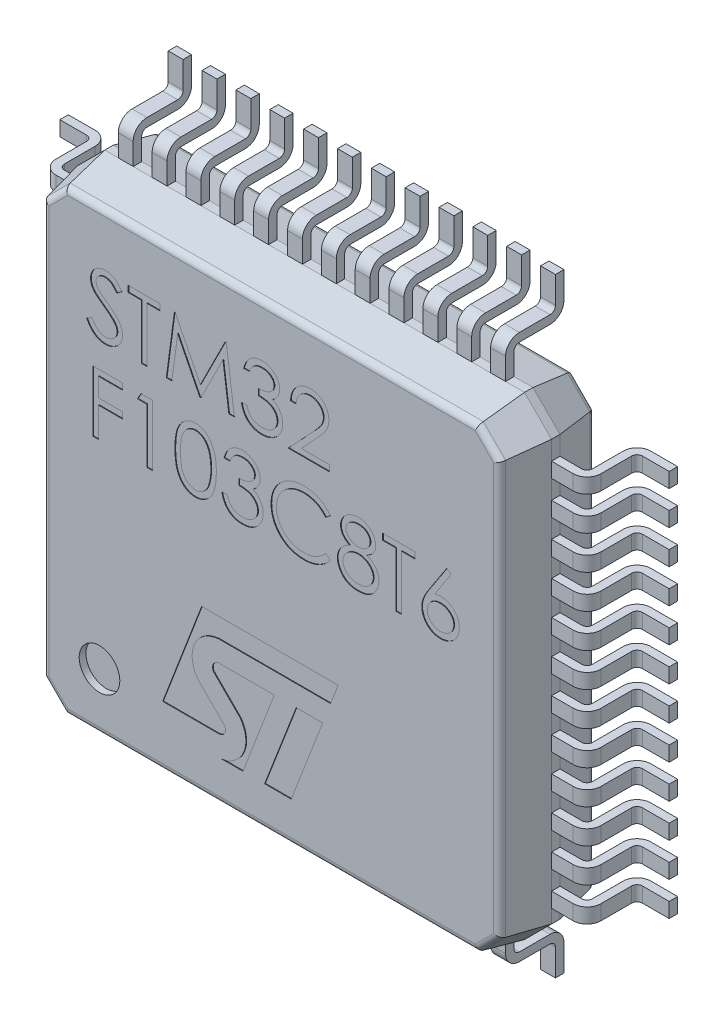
SolidWorks part; units mm, degrees
ref_plane "Front Plane" through (0, 0, 0) normal (0, 0, 1) x (1, 0, 0)
ref_plane "Top Plane" through (0, 0, 0) normal (0, 1, 0) x (1, 0, 0)
ref_plane "Right Plane" through (0, 0, 0) normal (1, 0, 0) x (0, 0, -1)
ref_plane "Plane1" through (0, 0, 0.1) normal (0, 0, 1) x (1, 0, 0)
sketch "Sketch1" plane through (0, 0, 0.1) normal (0, 0, 1) x (1, 0, 0)
  line L0 (-3.1, 3.5) -> (-3.5, 3.1)
  line L1 (-3.1, 3.5) -> (3.1, 3.5)
  line L2 (-3.5, 3.1) -> (-3.5, -3.1)
  line L3 (-3.1, -3.5) -> (3.1, -3.5)
  line L4 (3.5, 3.1) -> (3.5, -3.1)
  line L5 (-3.5, -3.1) -> (-3.1, -3.5)
  line L6 (3.1, -3.5) -> (3.5, -3.1)
  line L7 (3.1, 3.5) -> (3.5, 3.1)
extrude "Extrude1" add sketch "Sketch1" along normal blind 1.4
chamfer "Chamfer1" distance 0.6375 angle 12 16 edges at (-3.3, 3.3, 1.5) (0, 3.5, 1.5) (3.3, 3.3, 1.5) (3.5, 0, 1.5) (3.3, -3.3, 1.5) (0, -3.5, 1.5) (-3.3, -3.3, 1.5) (-3.5, 0, 1.5) (-3.3, -3.3, 0.1) (0, -3.5, 0.1) (3.3, -3.3, 0.1) (3.5, 0, 0.1) (3.3, 3.3, 0.1) (0, 3.5, 0.1) (-3.3, 3.3, 0.1) (-3.5, 0, 0.1)
fillet "Fillet1" radius 0.1 16 edges at (3.2042, 3.2042, 1.5) (3.3645, 0, 1.5) (3.2042, -3.2042, 1.5) (0, -3.3645, 1.5) (-3.2042, -3.2042, 1.5) (-3.3645, 0, 1.5) (-3.2042, 3.2042, 1.5) (0, 3.3645, 1.5) (3.2042, -3.2042, 0.1) (3.3645, 0, 0.1) (3.2042, 3.2042, 0.1) (0, 3.3645, 0.1) (-3.2042, 3.2042, 0.1) (-3.3645, 0, 0.1) (-3.2042, -3.2042, 0.1) (0, -3.3645, 0.1)
sketch "Sketch2" plane through (0, 0, 0) normal (0, 0, 1) x (1, 0, 0)
  line L0 (2.1, -3.5) -> (2.1, -4.5)
  line L2 (2.6, -3.5) -> (2.82, -3.5)
  line L3 (2.6, -3.5) -> (2.6, -4.5)
  line L4 (2.6, -4.5) -> (2.82, -4.5)
  line L5 (2.82, -3.5) -> (2.82, -4.5)
  line L6 (2.32, -3.5) -> (2.32, -4.5)
  line L7 (2.1, -3.5) -> (2.32, -3.5)
  line L8 (2.1, -4.5) -> (2.32, -4.5)
  line L9 (1.6, -3.5) -> (1.6, -4.5)
  line L10 (1.82, -3.5) -> (1.82, -4.5)
  line L11 (1.6, -3.5) -> (1.82, -3.5)
  line L12 (1.6, -4.5) -> (1.82, -4.5)
  line L13 (1.1, -3.5) -> (1.1, -4.5)
  line L14 (1.32, -3.5) -> (1.32, -4.5)
  line L15 (1.1, -3.5) -> (1.32, -3.5)
  line L16 (1.1, -4.5) -> (1.32, -4.5)
  line L17 (0.6, -3.5) -> (0.6, -4.5)
  line L18 (0.82, -3.5) -> (0.82, -4.5)
  line L19 (0.6, -3.5) -> (0.82, -3.5)
  line L20 (0.6, -4.5) -> (0.82, -4.5)
  line L21 (0.1, -3.5) -> (0.1, -4.5)
  line L22 (0.32, -3.5) -> (0.32, -4.5)
  line L23 (0.1, -3.5) -> (0.32, -3.5)
  line L24 (0.1, -4.5) -> (0.32, -4.5)
  line L25 (-0.4, -3.5) -> (-0.4, -4.5)
  line L26 (-0.18, -3.5) -> (-0.18, -4.5)
  line L27 (-0.4, -3.5) -> (-0.18, -3.5)
  line L28 (-0.4, -4.5) -> (-0.18, -4.5)
  line L29 (-0.9, -3.5) -> (-0.9, -4.5)
  line L30 (-0.68, -3.5) -> (-0.68, -4.5)
  line L31 (-0.9, -3.5) -> (-0.68, -3.5)
  line L32 (-0.9, -4.5) -> (-0.68, -4.5)
  line L33 (-1.4, -3.5) -> (-1.4, -4.5)
  line L34 (-1.18, -3.5) -> (-1.18, -4.5)
  line L35 (-1.4, -3.5) -> (-1.18, -3.5)
  line L36 (-1.4, -4.5) -> (-1.18, -4.5)
  line L37 (-1.9, -3.5) -> (-1.9, -4.5)
  line L38 (-1.68, -3.5) -> (-1.68, -4.5)
  line L39 (-1.9, -3.5) -> (-1.68, -3.5)
  line L40 (-1.9, -4.5) -> (-1.68, -4.5)
  line L41 (-2.4, -3.5) -> (-2.4, -4.5)
  line L42 (-2.18, -3.5) -> (-2.18, -4.5)
  line L43 (-2.4, -3.5) -> (-2.18, -3.5)
  line L44 (-2.4, -4.5) -> (-2.18, -4.5)
  line L45 (-2.9, -3.5) -> (-2.9, -4.5)
  line L46 (-2.68, -3.5) -> (-2.68, -4.5)
  line L47 (-2.9, -3.5) -> (-2.68, -3.5)
  line L48 (-2.9, -4.5) -> (-2.68, -4.5)
  dimension "D1" = 12
extrude "Extrude2" add sketch "Sketch2" along normal blind 0.8625
sketch "Sketch3" plane through (2.82, 0, 0) normal (1, 0, 0) x (0, 0, -1)
  line L0 (-0.6575, -3.9) -> (-0.205, -3.9)
  line L1 (-0.8625, -3.82) -> (-0.8625, -4.5)
  line L2 (-0.8625, -4.5) -> (-0.125, -4.5)
  line L3 (-0.7375, -3.5) -> (0, -3.5)
  line L4 (-0.7375, -3.5) -> (-0.7375, -3.82)
  line L5 (0, -3.5) -> (0, -4.105)
  line L6 (-0.125, -4.105) -> (-0.125, -4.5)
  line L7 (-0.6575, -4.025) -> (-0.205, -4.025)
  line L8 (-0.8625, -4.5) -> (0, -4.5) construction
  arc A0 (-0.7375, -3.82) -> (-0.6575, -3.9) centre (-0.6575, -3.82) ccw
  arc A1 (-0.8625, -3.82) -> (-0.6575, -4.025) centre (-0.6575, -3.82) ccw
  arc A2 (-0.125, -4.105) -> (-0.205, -4.025) centre (-0.205, -4.105) ccw
  arc A3 (0, -4.105) -> (-0.205, -3.9) centre (-0.205, -4.105) ccw
extrude "Extrude3" cut sketch "Sketch3" against normal through all
mirror "Mirror1" about plane through (0, 0, 0) normal (0, 1, 0) of "Extrude3", "Extrude2"
sketch "Sketch4" plane through (0, 0, 0) normal (0, 0, 1) x (1, 0, 0)
  line L1 (-3.5, -2.18) -> (-4.5, -2.18)
  line L2 (-4.5, -2.18) -> (-4.5, -2.4)
  line L3 (-3.5, -2.4) -> (-4.5, -2.4)
  line L4 (-3.5, -2.18) -> (-3.5, -2.4)
  line L5 (-3.5, -1.68) -> (-4.5, -1.68)
  line L6 (-4.5, -1.68) -> (-4.5, -1.9)
  line L7 (-3.5, -1.9) -> (-4.5, -1.9)
  line L8 (-3.5, -1.68) -> (-3.5, -1.9)
  line L9 (-3.5, -1.18) -> (-4.5, -1.18)
  line L10 (-4.5, -1.18) -> (-4.5, -1.4)
  line L11 (-3.5, -1.4) -> (-4.5, -1.4)
  line L12 (-3.5, -1.18) -> (-3.5, -1.4)
  line L13 (-3.5, -0.68) -> (-4.5, -0.68)
  line L14 (-4.5, -0.68) -> (-4.5, -0.9)
  line L15 (-3.5, -0.9) -> (-4.5, -0.9)
  line L16 (-3.5, -0.68) -> (-3.5, -0.9)
  line L17 (-3.5, -0.18) -> (-4.5, -0.18)
  line L18 (-4.5, -0.18) -> (-4.5, -0.4)
  line L19 (-3.5, -0.4) -> (-4.5, -0.4)
  line L20 (-3.5, -0.18) -> (-3.5, -0.4)
  line L21 (-3.5, 0.32) -> (-4.5, 0.32)
  line L22 (-4.5, 0.32) -> (-4.5, 0.1)
  line L23 (-3.5, 0.1) -> (-4.5, 0.1)
  line L24 (-3.5, 0.32) -> (-3.5, 0.1)
  line L25 (-3.5, 0.82) -> (-4.5, 0.82)
  line L26 (-4.5, 0.82) -> (-4.5, 0.6)
  line L27 (-3.5, 0.6) -> (-4.5, 0.6)
  line L28 (-3.5, 0.82) -> (-3.5, 0.6)
  line L29 (-3.5, 1.32) -> (-4.5, 1.32)
  line L30 (-4.5, 1.32) -> (-4.5, 1.1)
  line L31 (-3.5, 1.1) -> (-4.5, 1.1)
  line L32 (-3.5, 1.32) -> (-3.5, 1.1)
  line L33 (-3.5, 1.82) -> (-4.5, 1.82)
  line L34 (-4.5, 1.82) -> (-4.5, 1.6)
  line L35 (-3.5, 1.6) -> (-4.5, 1.6)
  line L36 (-3.5, 1.82) -> (-3.5, 1.6)
  line L37 (-3.5, 2.32) -> (-4.5, 2.32)
  line L38 (-4.5, 2.32) -> (-4.5, 2.1)
  line L39 (-3.5, 2.1) -> (-4.5, 2.1)
  line L40 (-3.5, 2.32) -> (-3.5, 2.1)
  line L41 (-3.5, -2.68) -> (-4.5, -2.68)
  line L42 (-4.5, -2.68) -> (-4.5, -2.9)
  line L43 (-3.5, -2.9) -> (-4.5, -2.9)
  line L44 (-3.5, -2.68) -> (-3.5, -2.9)
  line L45 (-3.5, 2.82) -> (-4.5, 2.82)
  line L46 (-4.5, 2.82) -> (-4.5, 2.6)
  line L47 (-3.5, 2.6) -> (-4.5, 2.6)
  line L48 (-3.5, 2.82) -> (-3.5, 2.6)
  dimension "D1" = 12
extrude "Extrude4" add sketch "Sketch4" along normal blind 0.8625
sketch "Sketch5" plane through (0, -2.9, 0) normal (0, -1, 0) x (1, 0, 0)
  line L0 (-3.9, 0.6575) -> (-3.9, 0.205)
  line L4 (-3.5, 0.7375) -> (-3.82, 0.7375)
  line L6 (-4.5, 0.125) -> (-4.105, 0.125)
  line L7 (-4.5, 0.8625) -> (-4.5, 0) construction
  line L8 (-4.025, 0.6575) -> (-4.025, 0.205)
  line L9 (-3.5, 0.7375) -> (-3.5, 0)
  line L10 (-3.5, 0) -> (-4.105, 0)
  line L11 (-3.82, 0.8625) -> (-4.5, 0.8625)
  line L12 (-4.5, 0.8625) -> (-4.5, 0.125)
  arc A0 (-3.82, 0.7375) -> (-3.9, 0.6575) centre (-3.82, 0.6575) ccw
  arc A1 (-3.82, 0.8625) -> (-4.025, 0.6575) centre (-3.82, 0.6575) ccw
  arc A2 (-4.025, 0.205) -> (-4.105, 0.125) centre (-4.105, 0.205) cw
  arc A3 (-3.9, 0.205) -> (-4.105, 0) centre (-4.105, 0.205) cw
extrude "Extrude5" cut sketch "Sketch5" against normal through all
mirror "Mirror2" about plane through (0, 0, 0) normal (1, 0, 0) of "Extrude5", "Extrude4"
sketch "Sketch6" plane through (0, 0, 1.5) normal (0, 0, 1) x (1, 0, 0)
  line L0 (-2.54, -3.5) -> (-2.54, -2.54) construction
  line L2 (-3.5, -2.54) -> (-2.54, -2.54) construction
  line L5 (-2.4, -3.5) -> (-2.68, -3.5) construction
  line L6 (-3.5, -2.68) -> (-3.5, -2.4) construction
  circle A0 centre (-2.54, -2.54) radius 0.3
extrude "Extrude6" cut sketch "Sketch6" against normal blind 0.1
sketch "Sketch7" plane through (0, 0, 1.5) normal (0, 0, 1) x (1, 0, 0)
  line L0 (-92.313, 157.0393) -> (404.3537, 157.0393) construction
  line L1 (0.985, -0.9845) -> (-1.0308, -0.9845)
  line L2 (-1.0308, -0.9845) -> (-1.6061, -2.4866)
  line L3 (-1.6061, -2.4866) -> (-0.7782, -2.4866)
  line L4 (-0.6974, -2.3345) -> (-1.0656, -1.9663)
  line L5 (-0.7782, -1.2738) -> (0.8744, -1.2738)
  line L6 (0.8744, -1.2738) -> (0.985, -0.9845)
  line L7 (-0.4212, -2.7876) -> (0.043, -1.5816)
  line L8 (0.043, -1.5816) -> (-0.7708, -1.5816)
  line L9 (-0.8556, -1.7319) -> (-0.4573, -2.1301)
  line L10 (-0.7369, -2.7876) -> (-0.4212, -2.7876)
  line L11 (0.3663, -1.5816) -> (0.7577, -1.5816)
  line L12 (0.7577, -1.5816) -> (0.2918, -2.7876)
  line L13 (0.2918, -2.7876) -> (-0.1004, -2.7876)
  line L14 (-0.1004, -2.7876) -> (0.3663, -1.5816)
  spline S0 degree 3 poles (-0.7782, -2.4866) (-0.745, -2.4865) (-0.6961, -2.4598) (-0.6752, -2.3906) (-0.6833, -2.3526) (-0.6974, -2.3345) knots 0 0 0 0 0.478706 0.677314 1 1 1 1
  spline S1 degree 3 poles (-1.0656, -1.9663) (-1.1063, -1.9235) (-1.1515, -1.841) (-1.1766, -1.6971) (-1.1647, -1.573) (-1.108, -1.4577) (-1.0171, -1.3509) (-0.8945, -1.2918) (-0.8043, -1.277) (-0.7782, -1.2738) knots 0 0 0 0 0.18983 0.294522 0.468646 0.580629 0.704401 0.915479 1 1 1 1
  spline S2 degree 3 poles (-0.7708, -1.5816) (-0.792, -1.5806) (-0.8321, -1.5939) (-0.8749, -1.6535) (-0.8692, -1.7058) (-0.8556, -1.7319) knots 0 0 0 0 0.305418 0.574312 1 1 1 1
  spline S3 degree 3 poles (-0.4573, -2.1301) (-0.4192, -2.186) (-0.3769, -2.2888) (-0.3752, -2.4432) (-0.4146, -2.5688) (-0.4907, -2.6692) (-0.5971, -2.7515) (-0.6825, -2.7844) (-0.7369, -2.7876) knots 0 0 0 0 0.236781 0.37815 0.532396 0.688336 0.810695 1 1 1 1
extrude "Cut-Extrude1" cut sketch "Sketch7" against normal blind 0.01
sketch "Sketch8" plane through (0, 0, 1.5) normal (0, 0, 1) x (1, 0, 0)
  text T0 "STM32" font "Century Gothic" height 0.9
  text T1 "F103C8T6" font "Century Gothic" height 0.9
extrude "Cut-Extrude2" cut sketch "Sketch8" against normal blind 0.01
